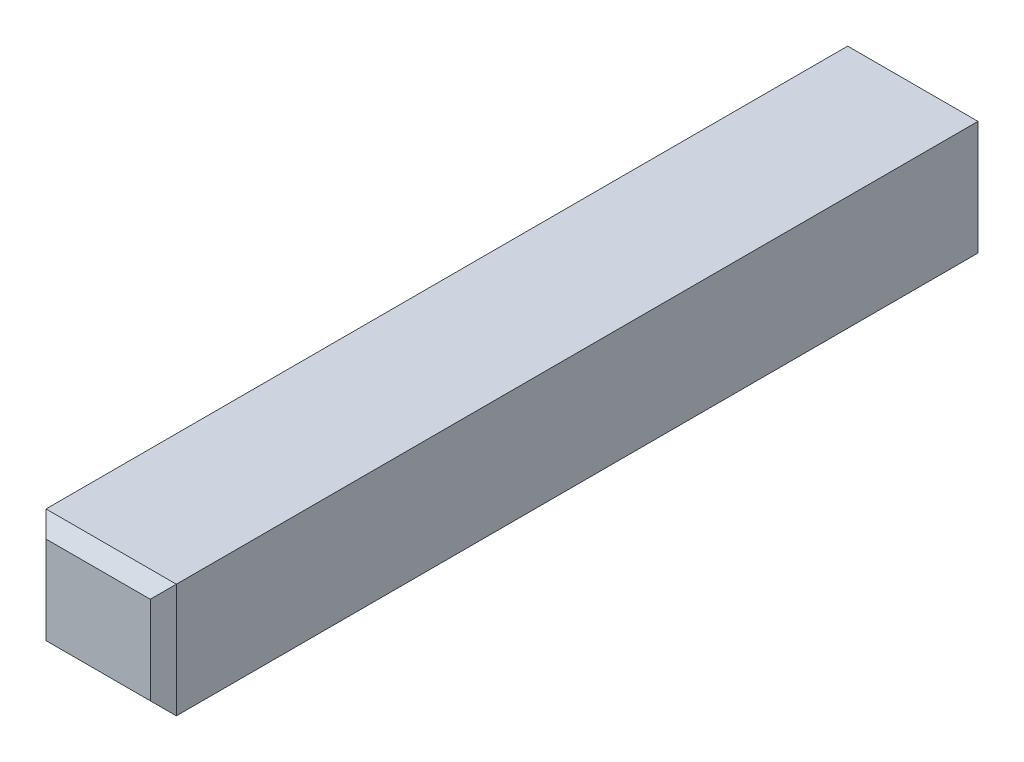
SolidWorks part; units mm, degrees
ref_plane "Front Plane" through (0, 0, 0) normal (0, 0, 1) x (1, 0, 0)
ref_plane "Top Plane" through (0, 0, 0) normal (0, 1, 0) x (1, 0, 0)
ref_plane "Right Plane" through (0, 0, 0) normal (1, 0, 0) x (0, 0, -1)
sketch "Sketch1" plane through (0, 0, 0) normal (0, 0, 1) x (1, 0, 0)
  line L1 (-4, -3.5) -> (4, -3.5)
  line L2 (-4, -3.5) -> (-4, 3.5)
  line L3 (-4, 3.5) -> (4, 3.5)
  line L4 (4, -3.5) -> (4, 3.5)
  line L5 (-4, -3.5) -> (4, 3.5) construction
  line L6 (-4, 3.5) -> (4, -3.5) construction
  point P0 (0, 0)
  dimension "D1" = 8
  dimension "D2" = 7
extrude "Boss-Extrude1" add sketch "Sketch1" along normal mid plane 50
chamfer "Chamfer1" distance 0.8 angle 45 4 edges at (0, -3.5, 25) (-4, 0, 25) (0, 3.5, 25) (4, 0, 25)
